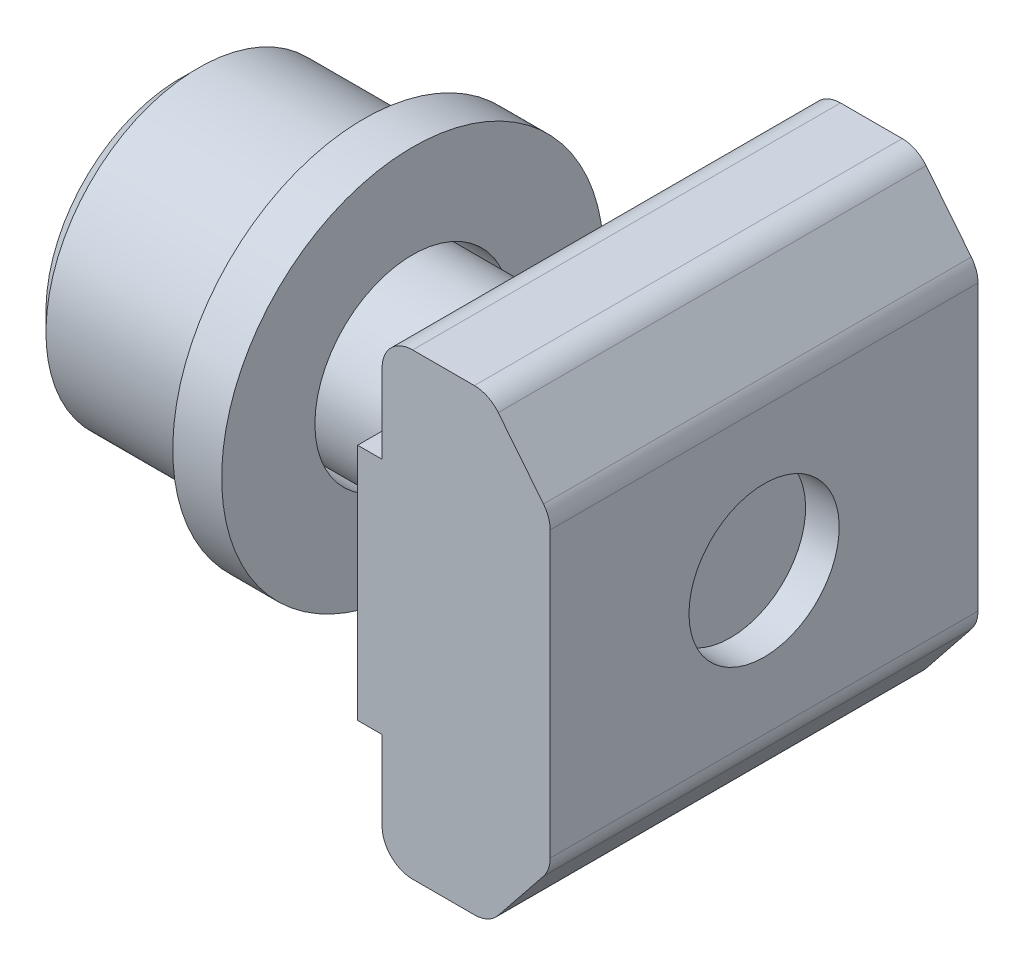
SolidWorks part; units mm, degrees
ref_plane "Front Plane" through (0, 0, 0) normal (0, 0, 1) x (1, 0, 0)
ref_plane "Top Plane" through (0, 0, 0) normal (0, 1, 0) x (1, 0, 0)
ref_plane "Right Plane" through (0, 0, 0) normal (1, 0, 0) x (0, 0, -1)
ref_plane "Plane1" through (3, 0, 0) normal (1, 0, 0) x (0, 0, -1)
sketch "Sketch1" plane through (0, 0, 0) normal (0, 0, 1) x (1, 0, 0)
  line L0 (-4.6, 2.5) -> (-3.1566, 0)
  line L1 (10.4, 0) -> (10.4, 3)
  line L2 (10.4, 3) -> (-1.6, 3)
  line L3 (10.4, 3) -> (10.4, -3) construction
  line L4 (-1.6, 5) -> (-7, 5)
  line L5 (-7, 5) -> (-7.6, 4.4)
  line L6 (-7.6, 4.4) -> (-7.6, 2.5)
  line L7 (-3.1566, 0) -> (10.4, 0) construction
  line L8 (-4.6, 2.5) -> (-7.6, 2.5)
  line L9 (-3.1566, 0) -> (10.4, 0)
  line L10 (-1.6, 5) -> (-1.6, -5) construction
  line L11 (-4.6, -2.5) -> (-3.1566, 0) construction
  line L12 (7.7, 0) -> (-7.7, 0) construction
  line L13 (-1.6, 5) -> (-1.6, 3)
  line L14 (-7.6, 4.4) -> (-7.6, 5) construction
  line L15 (-7, 5) -> (-7.6, 5) construction
  line L16 (0, -7.7) -> (0, 7.7) construction
  point P0 (-1.6, 0)
  dimension "FIX_1" = 10
  dimension "FIX_2" = 6
  dimension "FIX_3" = 12
  dimension "FIX_4" = 1.6
  dimension "FIX_5" = 3
  dimension "FIX_6" = 5
  dimension "FIX_7" = 120
  dimension "FIX_8" = 0.6
revolve "Revolve1" add sketch "Sketch1" angle 360 about L9
sketch "Sketch2" plane through (-7.6, 0, 0) normal (-1, 0, 0) x (0, 0, 1)
  line L1 (0, 2.8868) -> (-2.5, 1.4434)
  line L2 (-2.5, 1.4434) -> (-2.5, -1.4434)
  line L3 (-2.5, -1.4434) -> (0, -2.8868)
  line L4 (0, -2.8868) -> (2.5, -1.4434)
  line L5 (2.5, -1.4434) -> (2.5, 1.4434)
  line L6 (2.5, 1.4434) -> (0, 2.8868)
  circle A0 centre (0, 0) radius 2.5 construction
extrude "Cut-Extrude1" cut sketch "Sketch2" against normal up to vertex
sketch "Sketch3" plane through (0, 0, 0) normal (1, 0, 0) x (0, 0, -1)
  circle A0 centre (0, 0) radius 3.2
  circle A1 centre (0, 0) radius 6.25
  dimension "FIX_10" = 6.4
  dimension "FIX_11" = 12.5
extrude "Boss-Extrude1" add sketch "Sketch3" against normal up to surface (1.6 mm away) separate body
sketch "Sketch4" plane through (0, 0, 0) normal (0, 0, 1) x (1, 0, 0)
  line L0 (11.5, 0) -> (0, 0) construction
  line L1 (3, -7.7) -> (3, 7.7) construction
  line L3 (9.0194, 7.5) -> (9.5, 7.5) construction
  line L4 (9.8002, 7.1247) -> (9.5, 7.5) construction
  line L5 (11.2809, 5.2739) -> (11.5, 5) construction
  line L6 (11.2809, -5.2739) -> (11.5, -5) construction
  line L7 (11.5, -4.6492) -> (11.5, -5) construction
  line L8 (11.5, 4.6492) -> (11.5, 5) construction
  line L11 (11.5, -4.6492) -> (11.5, 4.6492)
  line L12 (11.2809, 5.2739) -> (9.8002, 7.1247)
  line L13 (9.0194, 7.5) -> (7, 7.5)
  line L14 (6, 6.5) -> (6, 3.9)
  line L15 (6, 3.9) -> (5.2, 3.9)
  line L16 (5.2, 3.9) -> (5.2, -3.9)
  line L17 (5.2, -3.9) -> (6, -3.9)
  line L18 (6, -3.9) -> (6, -6.5)
  line L19 (7, -7.5) -> (9.0194, -7.5)
  line L20 (9.8002, -7.1247) -> (11.2809, -5.2739)
  arc A6 (11.5, 4.6492) -> (11.2809, 5.2739) centre (10.5, 4.6492) ccw
  arc A7 (9.8002, 7.1247) -> (9.0194, 7.5) centre (9.0194, 6.5) ccw
  arc A8 (7, 7.5) -> (6, 6.5) centre (7, 6.5) ccw
  arc A9 (6, -6.5) -> (7, -7.5) centre (7, -6.5) ccw
  arc A10 (9.0194, -7.5) -> (9.8002, -7.1247) centre (9.0194, -6.5) ccw
  arc A11 (11.2809, -5.2739) -> (11.5, -4.6492) centre (10.5, -4.6492) ccw
  point P4 (5.2, 0)
  dimension "FIX_16" = 1
  dimension "FIX_12" = 7.8
  dimension "FIX_13" = 5.5
  dimension "FIX_14" = 15
  dimension "FIX_15" = 0.8
  dimension "FIX_17" = 3.5
  dimension "FIX_18" = 10
  dimension "FIX_19" = 3
extrude "Boss-Extrude2" add sketch "Sketch4" along normal mid plane 14 separate body
hole_wizard "Tap1" positions "Sketch5" profile "Sketch6" hole size "M6x1.0" standard "JIS"
sketch "Sketch5" plane through (5.2, 0, 0) normal (-1, 0, 0) x (0, 0, 1)
  point P0 (0, 0)
sketch "Sketch6" plane through (5.2, 0, 0) normal (0, 1, 0) x (0, 0, 1)
  line L0 (0, 0) -> (0, 5.2)
  line L1 (0, 5.2) -> (2.4585, 5.2)
  line L2 (2.4585, 5.2) -> (2.4585, 0)
  line L5 (2.4585, 0) -> (0, 0)
  line L11 (0, 0) -> (0, 5.2) construction
  dimension "Thru Hole Depth" = 5.2
equation "\"Factor\"= 1.082532"
equation "\"M\"= 6"
equation "\"Pitch\"= 1"
equation "\"HSD_1\"= round ( \"M\" - \"Factor\" * \"Pitch\" , 3 )"
equation "\"HTD_1\"= \"M\""
equation "\"ASD_1\"= \"M\""
equation "\"ATD_1\"= round ( \"M\" - \"Factor\" * \"Pitch\" , 3 )"
